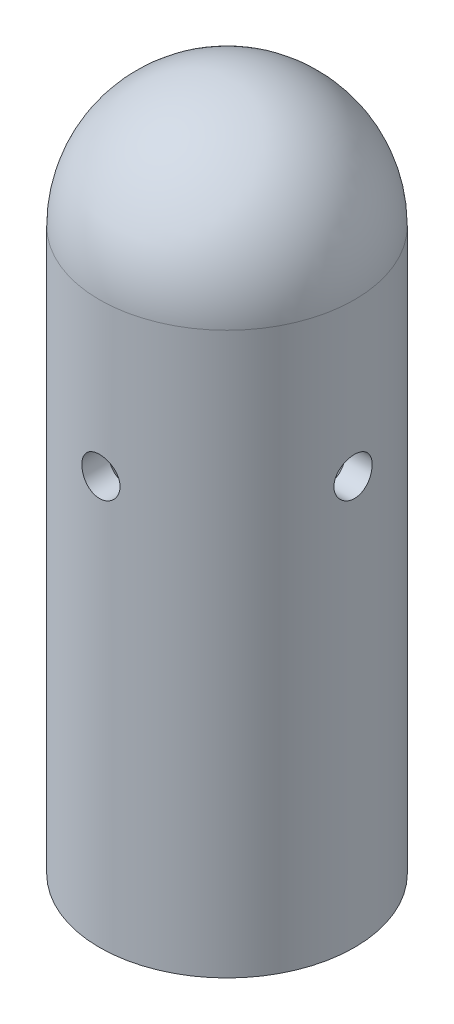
SolidWorks part; units mm, degrees
ref_plane "Front Plane" through (0, 0, 0) normal (0, 0, 1) x (1, 0, 0)
ref_plane "Top Plane" through (0, 0, 0) normal (0, 1, 0) x (1, 0, 0)
ref_plane "Right Plane" through (0, 0, 0) normal (1, 0, 0) x (0, 0, -1)
sketch "Sketch1" plane through (0, 0, 0) normal (0, 0, 1) x (1, 0, 0)
  line L1 (0, 0) -> (50, 0)
  line L2 (0, 0) -> (0, 70)
  line L4 (50, 0) -> (50, 70)
  line L5 (50, 70) -> (50, 220)
  line L6 (0, 70) -> (0, 270)
  arc A0 (50, 220) -> (0, 270) centre (0, 220) ccw
  dimension "D6" = 70
  dimension "D1" = 50
  dimension "D5" = 200
revolve "Revolve1" add sketch "Sketch1" angle 360 about L6
shell "Shell1" thickness 10
sketch "Sketch2" plane through (0, 0, 0) normal (0, 0, 1) x (1, 0, 0)
  line L2 (50, 220) -> (-50, 220) construction
  circle A0 centre (0, 160) radius 7.5
  dimension "D1" = 15
  dimension "D2" = 60
extrude "Cut-Extrude1" cut sketch "Sketch2" against normal through all both and the other way through all
sketch "Sketch3" plane through (0, 0, 0) normal (1, 0, 0) x (0, 0, -1)
  line L0 (50, 220) -> (-50, 220) construction
  circle A0 centre (0, 160) radius 7.5
  dimension "D1" = 15
  dimension "D2" = 60
extrude "Cut-Extrude2" cut sketch "Sketch3" against normal through all both and the other way through all
